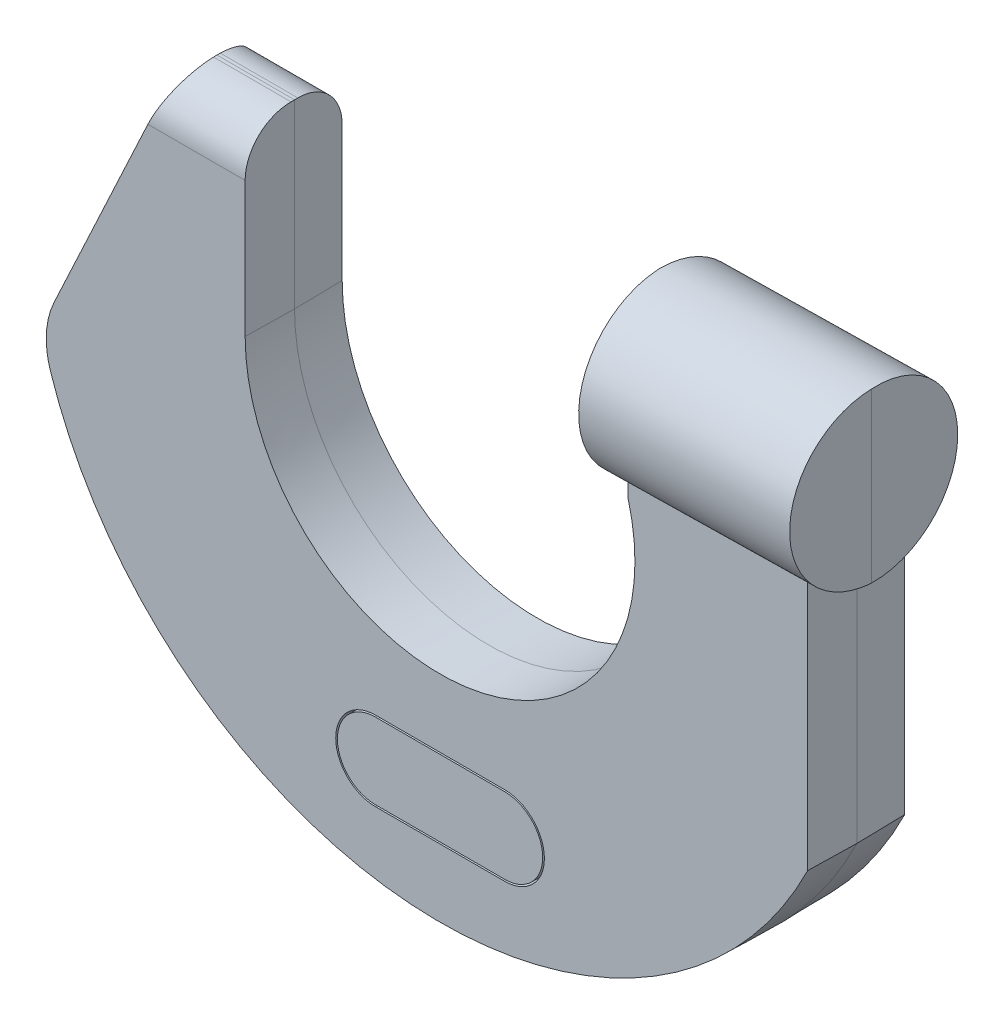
SolidWorks part; units mm, degrees
ref_plane "Plan de face" through (0, 0, 0) normal (0, 0, 1) x (1, 0, 0)
ref_plane "Plan de dessus" through (0, 0, 0) normal (0, 1, 0) x (1, 0, 0)
ref_plane "Plan de droite" through (0, 0, 0) normal (1, 0, 0) x (0, 0, -1)
sketch "Esquisse1" plane through (0, 0, 0) normal (0, 0, 1) x (1, 0, 0)
  line L0 (-15, 0) -> (-15, 14)
  line L1 (-15, 14) -> (-21, 14)
  line L2 (-21, 14) -> (-30.9105, -7.253)
  line L3 (-30.9105, -7.253) -> (-21, 14)
  line L4 (14.4706, 3.95) -> (14.4706, 6.95)
  line L5 (-5, -23.375) -> (5, -23.375) construction
  line L6 (-15, 10.45) -> (13.35, 10.45) construction
  line L7 (-5, -20.375) -> (5, -20.375)
  line L8 (-5, -26.375) -> (5, -26.375)
  line L9 (0, -31.75) -> (0, -15) construction
  line L10 (28.4794, 3.95) -> (28.4794, -14.0351)
  line L11 (13.35, 10.45) -> (29.6, 10.45) construction
  line L12 (14.4706, 3.95) -> (28.4794, 3.95)
  line L13 (14.4706, 6.95) -> (28.4794, 6.95)
  line L14 (28.4794, 6.95) -> (28.4794, 3.95)
  arc A0 (-15, 0) -> (14.4706, 3.95) centre (0, 0) ccw
  arc A1 (-30.9105, -7.253) -> (28.4794, -14.0351) centre (0, 0) ccw
  arc A2 (-5, -20.375) -> (-5, -26.375) centre (-5, -23.375) ccw
  arc A3 (5, -26.375) -> (5, -20.375) centre (5, -23.375) ccw
  point P12 (0, -31.75)
  point P13 (0, -23.375)
extrude "Boss.-Extru.1" add sketch "Esquisse1" along normal mid plane 7.5 draft 1
fillet "Congé1" radius 3.55 2 edges at (-18.0119, 13.9345, 3.75) (-18.0119, 13.9345, -3.75)
ref_plane "Plan1" through (13.3459, 0, -0.233) normal (0.9998, 0, -0.0175) x (-0.0175, 0, -0.9998)
sketch "Esquisse3" plane through (13.3459, 0, -0.233) normal (0.9998, 0, -0.0175) x (-0.0175, 0, -0.9998)
  circle A1 centre (-0.233, 10.45) radius 6.5
  circle A2 centre (-0.233, 10.45) radius 5
  dimension "D1" = 13
  dimension "D2" = 10
extrude "Boss.-Extru.2" add sketch "Esquisse3" along normal blind 16.25 contours A2 | A1 A2
fillet "Congé2" radius 6.5 1 edges
draft "Dépouille3" draft angle 1 neutral plane "Plan de face" parameters "D1"=1, "D2"=1
equation "\"D14@Esquisse1\"=\"D13@Esquisse1\""
equation "\"D3@Esquisse1\"=\"D15@Esquisse1\"*2"
